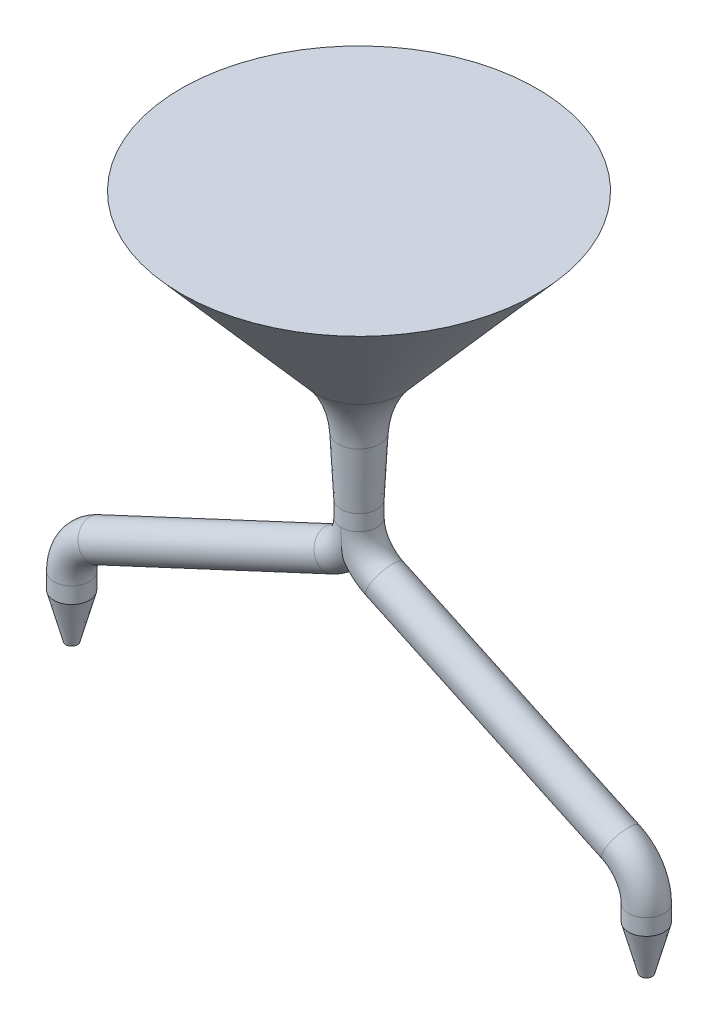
SolidWorks part; units mm, degrees
ref_plane "Front Plane" through (0, 0, 0) normal (0, 0, 1) x (1, 0, 0)
ref_plane "Top Plane" through (0, 0, 0) normal (0, 1, 0) x (1, 0, 0)
ref_plane "Right Plane" through (0, 0, 0) normal (1, 0, 0) x (0, 0, -1)
sketch "Sketch1" plane through (0, 0, 0) normal (0, 0, 1) x (1, 0, 0)
  line L0 (0, 0) -> (0, 30) construction
  line L1 (-20, 30) -> (20, 30) construction
  line L2 (20, 30) -> (2.5, 10)
  line L3 (2.5, 10) -> (-2.5, 10) construction
  line L4 (-2.5, 10) -> (-20, 30) construction
  line L5 (2.5, 10) -> (2, 0)
  line L6 (2, 0) -> (0, 0)
  line L7 (0, 0) -> (0, 30)
  line L8 (20, 30) -> (0, 30)
  point P5 (0.7322, 100)
  point P8 (0, 10)
  dimension "D1" = 40
  dimension "D2" = 30
  dimension "D3" = 20
  dimension "D4" = 5
  dimension "D5" = 2
sketch "Sketch2" plane through (0, 0, 0) normal (0, 0, 1) x (1, 0, 0)
  line L0 (0, 0) -> (0, 30) construction
  line L1 (20, 30) -> (0, 30) construction
  line L2 (20, 30) -> (2.5, 10) construction
  line L3 (2.5, 10) -> (2, 0) construction
  line L4 (2, 0) -> (0, 0) construction
  line L5 (0, 0) -> (0, 30)
  line L6 (20, 30) -> (0, 30)
  line L7 (20, 30) -> (2.5, 10)
  line L8 (2.5, 10) -> (2, 0)
  line L9 (2, 0) -> (0, 0)
revolve "Revolve1" add sketch "Sketch2" angle 360 about L5
sketch "Sketch5" plane through (0, 0, 0) normal (0, 0, 1) x (1, 0, 0)
  line L0 (2.8869, -6.2798) -> (29.4231, -18.6538)
  line L1 (32.31, -23.1854) -> (32.31, -25)
  line L2 (0, -1.7482) -> (0, 0)
  arc A0 (29.4231, -18.6538) -> (32.31, -23.1854) centre (27.31, -23.1854) cw
  arc A1 (2.8869, -6.2798) -> (0, -1.7482) centre (5, -1.7482) cw
  point P3 (21.4576, -18.0704)
  point P6 (32.31, -20)
  dimension "D5" = 5
  dimension "D6" = 5
  dimension "D1" = 115
  dimension "D2" = 25
  dimension "D3" = 32.31
  dimension "D4" = 5
sketch "Sketch7" plane through (0, 0, 0) normal (0, -1, 0) x (1, 0, 0)
  circle A1 centre (0, 0) radius 2
  circle A2 centre (0, 0) radius 2
  dimension "D1" = 0
sweep "Sweep2" add profiles "Sketch7" path "Sketch5"
fillet "Fillet1" radius 10 1 edges at (0, 10, -2.5)
sketch "Sketch9" plane through (0, -25, 0) normal (0, -1, 0) x (1, 0, 0)
  circle A2 centre (32.31, 0) radius 2
  circle A3 centre (32.31, 0) radius 2
  dimension "D1" = 0
extrude "Boss-Extrude1" add sketch "Sketch9" along normal blind 5 draft 15
mirror "Mirror1" about plane through (0, 0, 0) normal (1, 0, 0) of "Boss-Extrude1", "Sweep2"
